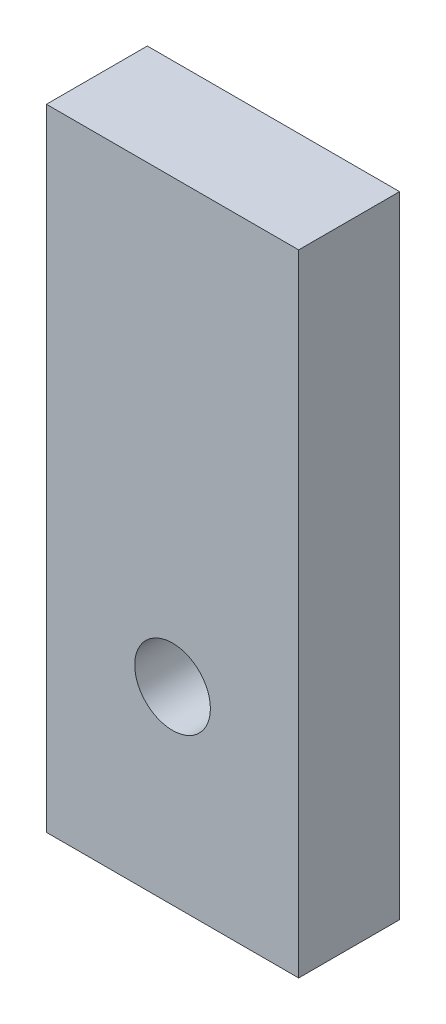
SolidWorks part; units mm, degrees
ref_plane "Front" through (0, 0, 0) normal (0, 0, 1) x (1, 0, 0)
ref_plane "Top" through (0, 0, 0) normal (0, 1, 0) x (1, 0, 0)
ref_plane "Right" through (0, 0, 0) normal (1, 0, 0) x (0, 0, -1)
sketch "Sketch1" plane through (0, 0, 0) normal (0, 0, 1) x (1, 0, 0)
  line L1 (0, 0) -> (10, 0)
  line L2 (0, 0) -> (0, 25)
  line L3 (0, 25) -> (10, 25)
  line L4 (10, 0) -> (10, 25)
  circle A0 centre (5, 7.5) radius 1.5
  dimension "D3" = 3
  dimension "D1" = 25
  dimension "D2" = 10
  dimension "D4" = 5
  dimension "D5" = 7.5
extrude "Boss-Extrude1" add sketch "Sketch1" along normal blind 4
